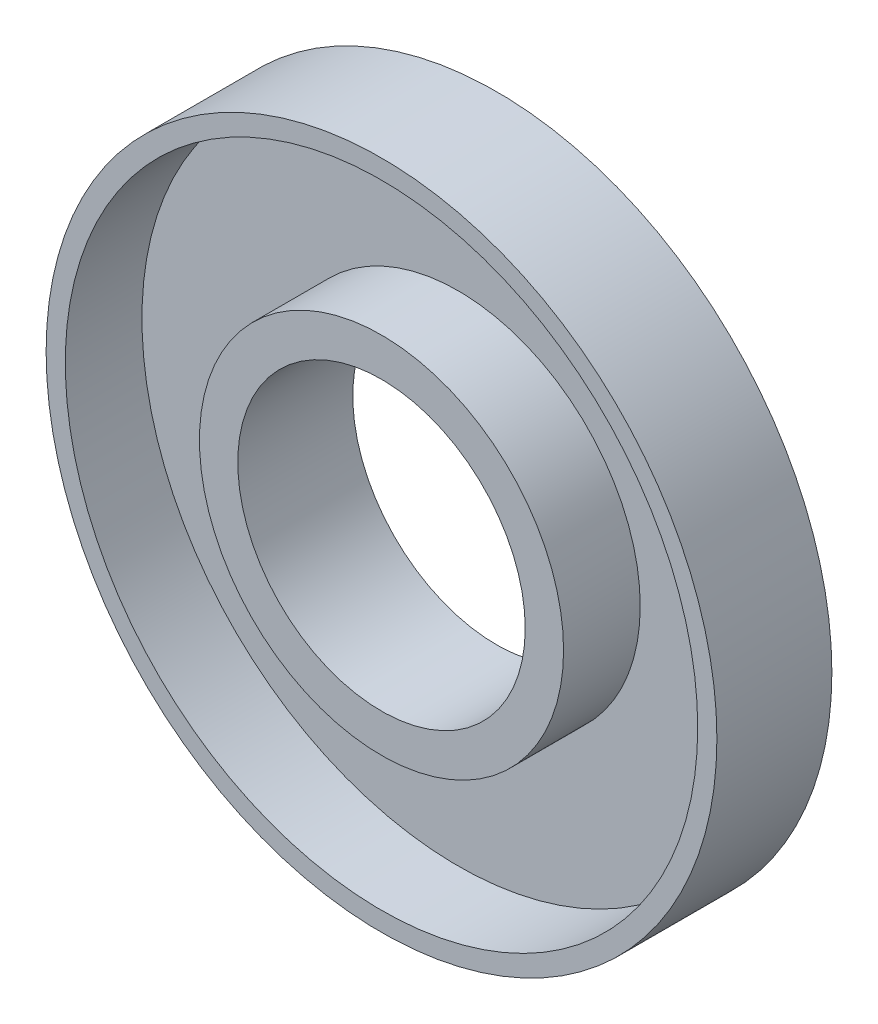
SolidWorks part; units mm, degrees
ref_plane "Plan de face" through (0, 0, 0) normal (0, 0, 1) x (1, 0, 0)
ref_plane "Plan de dessus" through (0, 0, 0) normal (0, 1, 0) x (1, 0, 0)
ref_plane "Plan de droite" through (0, 0, 0) normal (1, 0, 0) x (0, 0, -1)
sketch "Esquisse1" plane through (0, 0, 0) normal (0, 0, 1) x (1, 0, 0)
  circle A0 centre (0, 0) radius 17.5
  circle A1 centre (0, 0) radius 7.5
  dimension "D1" = 35
  dimension "D2" = 15
extrude "Boss.-Extru.1" add sketch "Esquisse1" along normal blind 2
sketch "Esquisse2" plane through (0, 0, 2) normal (0, 0, 1) x (1, 0, 0)
  circle A1 centre (0, 0) radius 17.5
  circle A2 centre (0, 0) radius 17.5 construction
  circle A3 centre (0, 0) radius 16.5
  dimension "D1" = 1
extrude "Boss.-Extru.2" add sketch "Esquisse2" along normal blind 4
sketch "Esquisse3" plane through (0, 0, 2) normal (0, 0, 1) x (1, 0, 0)
  circle A0 centre (0, 0) radius 7.5
  circle A1 centre (0, 0) radius 9.5
  circle A2 centre (0, 0) radius 7.5 construction
  dimension "D1" = 2
extrude "Boss.-Extru.3" add sketch "Esquisse3" along normal blind 4
